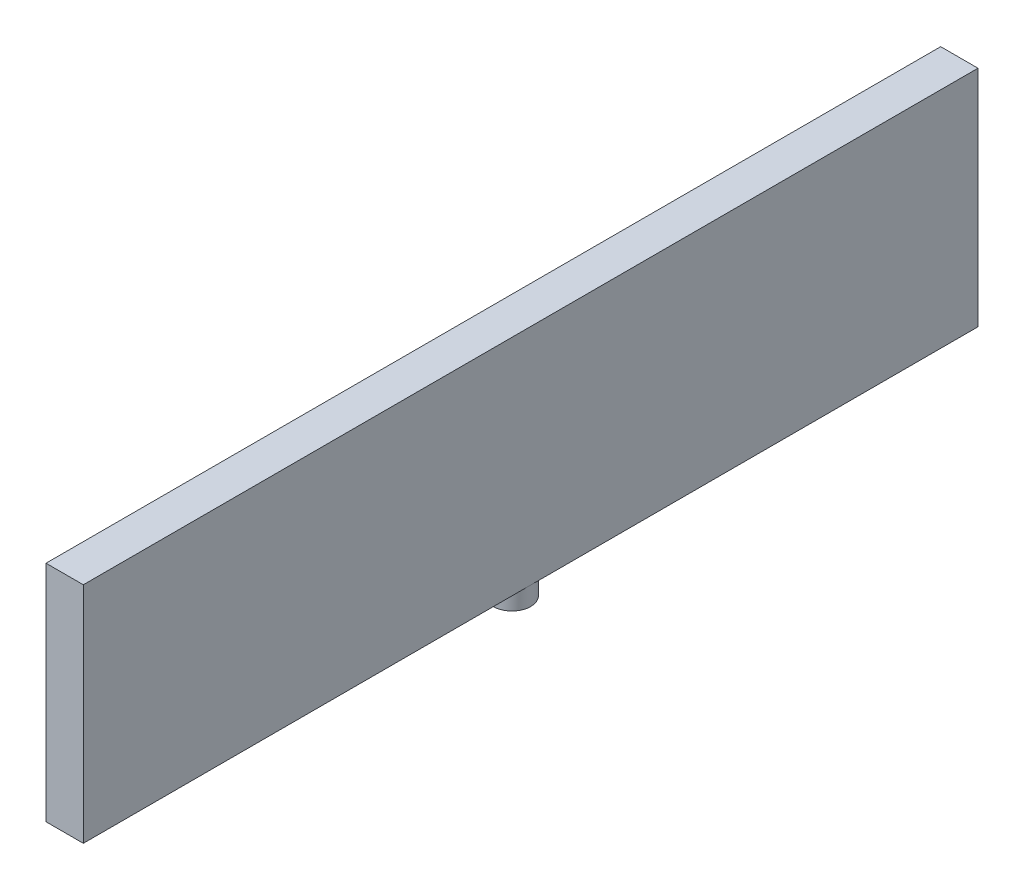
SolidWorks part; units mm, degrees
ref_plane "Front Plane" through (0, 0, 0) normal (0, 0, 1) x (1, 0, 0)
ref_plane "Top Plane" through (0, 0, 0) normal (0, 1, 0) x (1, 0, 0)
ref_plane "Right Plane" through (0, 0, 0) normal (1, 0, 0) x (0, 0, -1)
sketch "Sketch1" plane through (0, 0, 0) normal (0, 0, 1) x (1, 0, 0)
  line L1 (-175.3329, 123.1871) -> (-162.6329, 123.1871)
  line L2 (-175.3329, 123.1871) -> (-175.3329, 199.3871)
  line L3 (-175.3329, 199.3871) -> (-162.6329, 199.3871)
  line L4 (-162.6329, 123.1871) -> (-162.6329, 199.3871)
  line L6 (-175.3329, 199.3871) -> (-480.1329, 199.3871) construction
  line L7 (-175.3329, 123.1871) -> (-480.1329, 123.1871) construction
  dimension "D2" = 12.7
extrude "Extrude1" add sketch "Sketch1" against normal up to surface (304.4261 mm away)
sketch "Sketch2" plane through (0, 123.1871, 0) normal (0, -1, 0) x (1, 0, 0)
  line L0 (-168.9829, 0) -> (-168.9829, -304.4261) construction
  line L1 (-175.3329, 0) -> (-162.6329, 0) construction
  line L2 (-162.6329, -304.4261) -> (-175.3329, -304.4261) construction
  circle A0 centre (-168.9829, -152.2131) radius 6.35
  dimension "D1" = 12.7
extrude "Extrude2" add sketch "Sketch2" along normal blind 6.35
